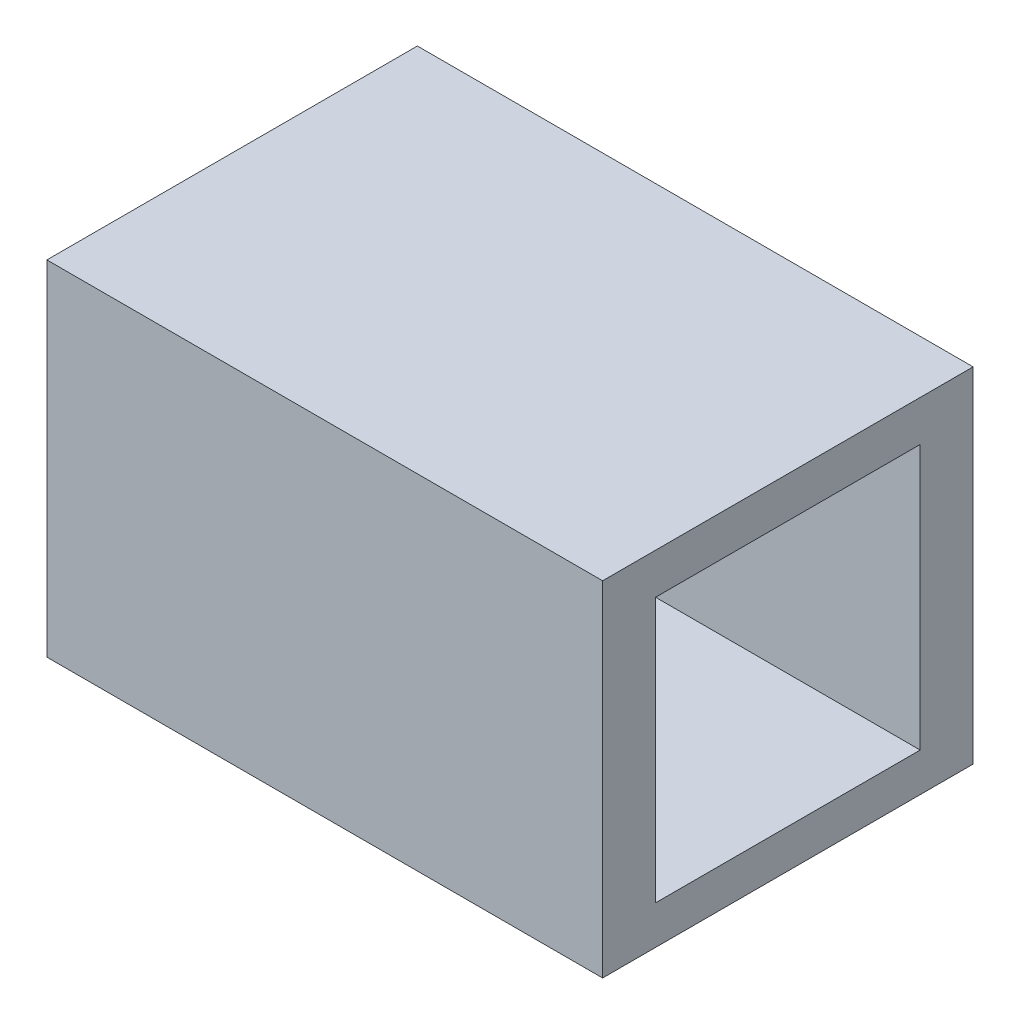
SolidWorks part; units mm, degrees
ref_plane "Front Plane" through (0, 0, 0) normal (0, 0, 1) x (1, 0, 0)
ref_plane "Top Plane" through (0, 0, 0) normal (0, 1, 0) x (1, 0, 0)
ref_plane "Right Plane" through (0, 0, 0) normal (1, 0, 0) x (0, 0, -1)
sketch "Sketch2" plane through (0, 0, 0) normal (0, 0, 1) x (1, 0, 0)
  line L1 (-10.5, 6.5) -> (10.5, 6.5)
  line L2 (-10.5, 6.5) -> (-10.5, -6.5)
  line L3 (-10.5, -6.5) -> (10.5, -6.5)
  line L4 (10.5, 6.5) -> (10.5, -6.5)
  line L5 (-10.5, 6.5) -> (10.5, -6.5) construction
  line L6 (-10.5, -6.5) -> (10.5, 6.5) construction
  point P0 (0, 0)
  dimension "D1" = 13
  dimension "D2" = 21
extrude "Boss-Extrude1" add sketch "Sketch2" along normal blind 14
sketch "Sketch3" plane through (10.5, 0, 0) normal (1, 0, 0) x (0, 0, -1)
  line L0 (0, 55) -> (0, -55) construction
  line L1 (-12, -5.04) -> (-2, -5.04)
  line L2 (-12, -5.04) -> (-12, 4.96)
  line L3 (-12, 4.96) -> (-2, 4.96)
  line L4 (-2, -5.04) -> (-2, 4.96)
  line L5 (-12, -5.04) -> (-2, 4.96) construction
  line L6 (-12, 4.96) -> (-2, -5.04) construction
  point P0 (-7, -0.04)
  dimension "D1" = 10
  dimension "D2" = 10
  dimension "D3" = 2
extrude "Cut-Extrude1" cut sketch "Sketch3" against normal blind 17
